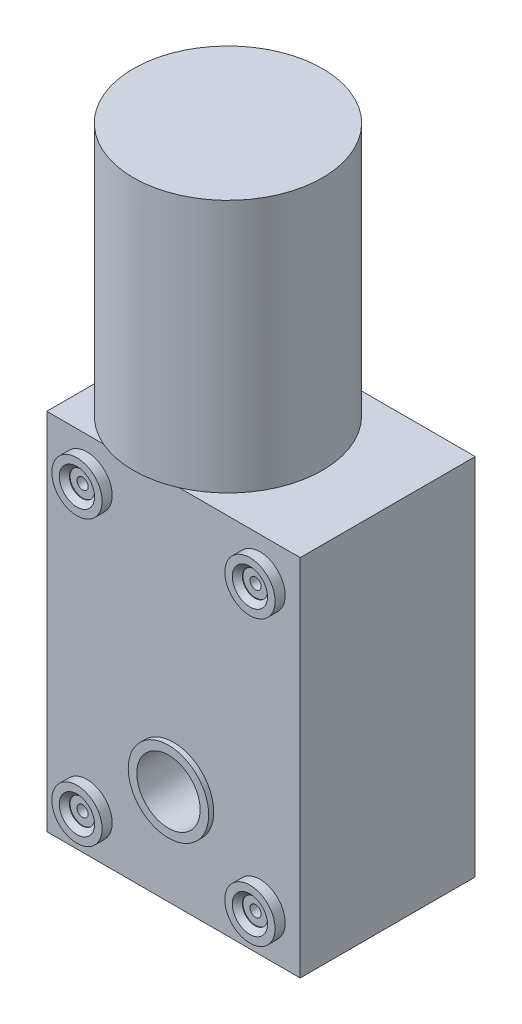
SolidWorks part; units mm, degrees
ref_plane "Front Plane" through (0, 0, 0) normal (0, 0, 1) x (1, 0, 0)
ref_plane "Top Plane" through (0, 0, 0) normal (0, 1, 0) x (1, 0, 0)
ref_plane "Right Plane" through (0, 0, 0) normal (1, 0, 0) x (0, 0, -1)
sketch "Sketch1" plane through (0, 0, 0) normal (0, 1, 0) x (1, 0, 0)
  line L1 (0, 0) -> (32.004, 0)
  line L2 (0, 0) -> (0, 22.098)
  line L3 (0, 22.098) -> (32.004, 22.098)
  line L4 (32.004, 0) -> (32.004, 22.098)
  dimension "D1" = 22.098
  dimension "D2" = 32.004
extrude "Boss-Extrude1" add sketch "Sketch1" along normal blind 45.974
sketch "Sketch2" plane through (0, 45.974, 0) normal (0, 1, 0) x (1, 0, 0)
  line L0 (0, 22.098) -> (0, 0) construction
  circle A0 centre (11.938, 10.9404) radius 11.938
  dimension "D1" = 23.876
extrude "Boss-Extrude2" add sketch "Sketch2" along normal blind 32.004
sketch "Sketch3" plane through (0, 0, 0) normal (0, 0, 1) x (1, 0, 0)
  line L0 (0, 45.974) -> (0, 0) construction
  line L1 (0, 0) -> (32.004, 0) construction
  line L2 (0, 45.974) -> (7.1607, 45.974) construction
  line L3 (16.7153, 45.974) -> (32.004, 45.974) construction
  line L4 (32.004, 45.974) -> (32.004, 0) construction
  circle A0 centre (5.08, 5.08) radius 3.175
  circle A1 centre (5.08, 40.894) radius 3.175
  circle A2 centre (26.924, 40.894) radius 3.175
  circle A3 centre (26.924, 5.08) radius 3.175
  dimension "D1" = 6.35
  dimension "D2" = 5.08
  dimension "D3" = 5.08
  dimension "D4" = 5.08
  dimension "D5" = 5.08
  dimension "D6" = 5.08
  dimension "D7" = 5.08
  dimension "D8" = 5.08
  dimension "D9" = 5.08
extrude "Boss-Extrude3" add sketch "Sketch3" along normal blind 1.27 contours A1 | A2 | A3 | A0
sketch "Sketch5" plane through (0, 0, 0) normal (0, 0, 1) x (1, 0, 0)
  line L0 (0, 0) -> (0, 12.7)
  line L1 (0, 45.974) -> (0, 0) construction
  line L2 (0, 12.7) -> (32.004, 12.7)
  line L3 (32.004, 45.974) -> (32.004, 0) construction
  circle A0 centre (16.002, 12.7) radius 5.08
  dimension "D2" = 10.16
  dimension "D1" = 12.7
extrude "Boss-Extrude4" add sketch "Sketch5" along normal blind 0.635 contours A0
sketch "Sketch6" plane through (0, 0, 1.27) normal (0, 0, 1) x (1, 0, 0)
  line L0 (5.08, 44.069) -> (5.08, 40.894)
  line L1 (26.924, 44.069) -> (26.924, 40.894)
  line L2 (26.924, 1.905) -> (26.924, 5.08)
  line L3 (5.08, 1.905) -> (5.08, 5.08)
  circle A0 centre (5.08, 40.894) radius 3.175 construction
  circle A1 centre (5.08, 40.894) radius 3.175 construction
  circle A2 centre (26.924, 40.894) radius 3.175 construction
  circle A3 centre (26.924, 40.894) radius 3.175 construction
  circle A4 centre (26.924, 5.08) radius 3.175 construction
  circle A5 centre (26.924, 5.08) radius 3.175 construction
  circle A6 centre (5.08, 5.08) radius 3.175 construction
  circle A7 centre (5.08, 5.08) radius 3.175 construction
  point P1 (5.08, 40.894)
  point P8 (26.924, 40.894)
  point P15 (26.924, 5.08)
  point P22 (5.08, 5.08)
hole_wizard "CBORE for #00 Binding Head Machine Screw1" positions "Sketch6" profile "Sketch7" counterbore size "#00" standard "ANSI Inch"
sketch "Sketch7" plane through (5.08, 5.08, 1.27) normal (1, 0, 0) x (0, -1, 0)
  line L0 (0, 0) -> (0, 13.1197)
  line L1 (0, 13.1197) -> (0.6985, 12.7)
  line L2 (0.6985, 12.7) -> (0.6985, 0.7112)
  line L3 (0.6985, 0.7112) -> (1.5875, 0.7112)
  line L5 (1.5875, 0.7112) -> (1.5875, 0.635)
  line L6 (1.5875, 0.635) -> (2.2225, 0)
  line L7 (2.2225, 0) -> (0, 0)
  line L8 (-1.5875, 0.635) -> (-2.2225, 0) construction
  line L10 (0, 13.1197) -> (-0.6985, 12.7) construction
  line L11 (0, -6.35) -> (0, 107.95) construction
  dimension "Hole Dia." = 1.397
  dimension "Hole Depth" = 12.7
  dimension "C'Bore Dia." = 3.175
  dimension "C'Bore Depth" = 0.7112
  dimension "Near C'Sink Dia." = 4.445
  dimension "Near C'Sink Angle" = 90
  dimension "Drill Angle" = 118
sketch "Sketch8" plane through (0, 0, 0.635) normal (0, 0, 1) x (1, 0, 0)
  circle A0 centre (16.002, 12.7) radius 4.0005
  dimension "D1" = 8.001
extrude "Cut-Extrude1" cut sketch "Sketch8" against normal blind 12.7
